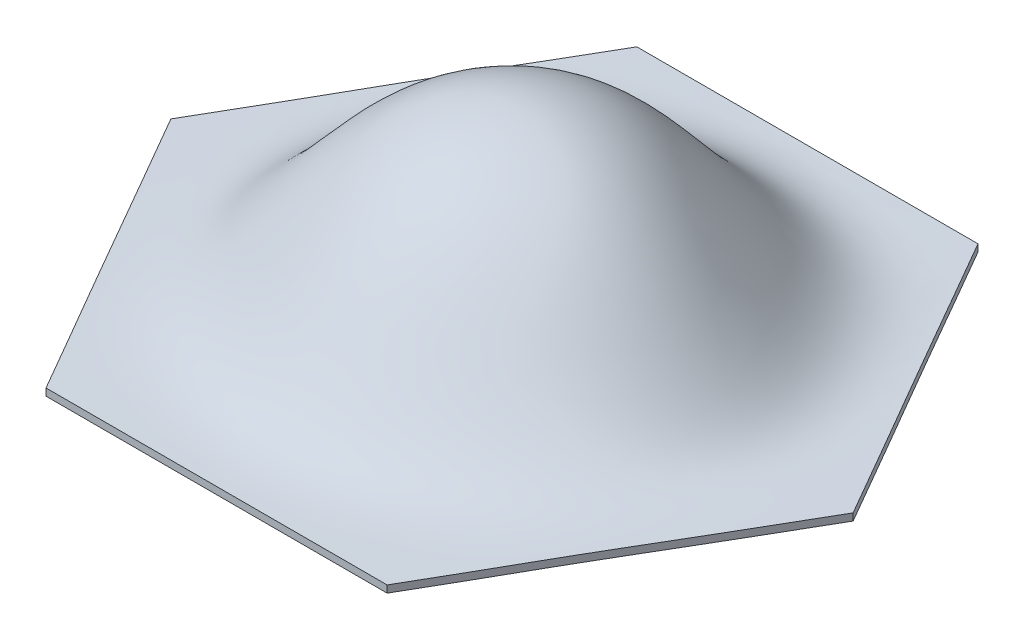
SolidWorks part; units mm, degrees
ref_plane "Front Plane" through (0, 0, 0) normal (0, 0, 1) x (1, 0, 0)
ref_plane "Top Plane" through (0, 0, 0) normal (0, 1, 0) x (1, 0, 0)
ref_plane "Right Plane" through (0, 0, 0) normal (1, 0, 0) x (0, 0, -1)
sketch "Sketch1" plane through (0, 0, 0) normal (0, 1, 0) x (1, 0, 0)
  line L0 (54.3639, -50.5343) -> (-54.3639, 50.5343) construction
  line L1 (-54.3639, 50.5343) -> (54.3639, 50.5343) construction
  line L2 (-54.3639, 50.5343) -> (-54.3639, -50.5343) construction
  line L3 (-54.3639, -50.5343) -> (54.3639, -50.5343) construction
  line L4 (54.3639, 50.5343) -> (54.3639, -50.5343) construction
  line L6 (173.2051, 0) -> (86.6025, 150)
  line L7 (86.6025, 150) -> (-86.6025, 150)
  line L8 (-86.6025, 150) -> (-173.2051, 0)
  line L9 (-173.2051, 0) -> (-86.6025, -150)
  line L10 (-86.6025, -150) -> (86.6025, -150)
  line L11 (86.6025, -150) -> (173.2051, 0)
  circle A0 centre (0, 0) radius 150 construction
  dimension "D1" = 300
extrude "Extrude1" add sketch "Sketch1" along normal blind 3.6188
other "Deform2" parameters "D1"=10, "D2"=10
